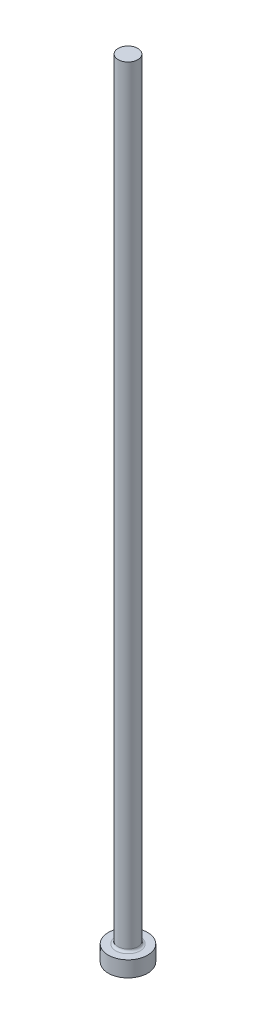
SolidWorks part; units mm, degrees
ref_plane "Plano frontal" through (0, 0, 0) normal (0, 0, 1) x (1, 0, 0)
ref_plane "Plano superior" through (0, 0, 0) normal (0, 1, 0) x (1, 0, 0)
ref_plane "Plano direito" through (0, 0, 0) normal (1, 0, 0) x (0, 0, -1)
sketch "Esboço1" plane through (0, 0, 0) normal (0, 0, 1) x (1, 0, 0)
  line L0 (0, 0) -> (2.5, 0)
  line L1 (2.5, 0) -> (2.5, 2)
  line L2 (2.5, 2) -> (1.55, 2)
  line L3 (1.25, 2.3) -> (1.25, 100)
  line L4 (1.25, 100) -> (0, 100)
  line L5 (0, 100) -> (0, 0) construction
  line L6 (0, 0) -> (0, 100)
  arc A0 (1.55, 2) -> (1.25, 2.3) centre (1.55, 2.3) cw
  dimension "D3" = 0.3
  dimension "D1" = 5
  dimension "D2" = 2.5
  dimension "D4" = 2
  dimension "D5" = 100
revolve "Revolução1" add sketch "Esboço1" angle 360 about L5
sketch "Esboço2"
  dimension "D1" = 0.2812
  dimension "D2" = 0.4375
  dimension "D3" = 0.1875
  dimension "D4" = 1.3438
wrap "Envolver1" sketch "Esboço2" wrap type deboss source sketch "Esboço2" thickness 0.1 parameters "D1"=0.1
